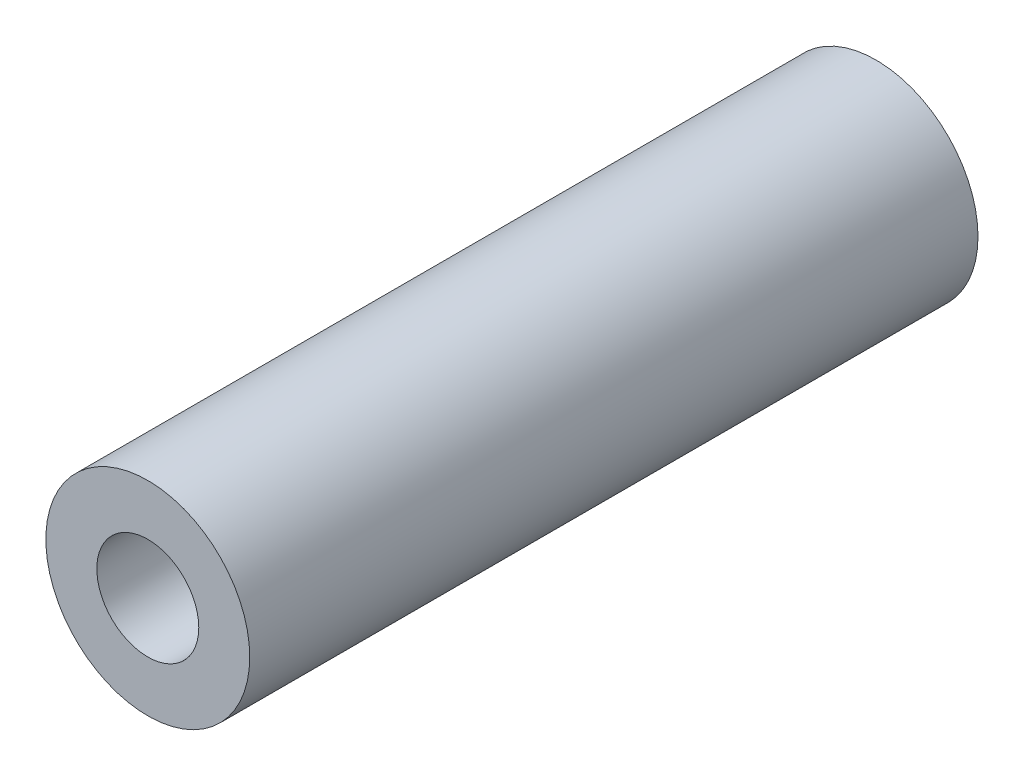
SolidWorks part; units mm, degrees
ref_plane "Plan1" through (0, 0, 0) normal (0, 0, 1) x (1, 0, 0)
ref_plane "Plan2" through (0, 0, 0) normal (0, 1, 0) x (1, 0, 0)
ref_plane "Plan3" through (0, 0, 0) normal (1, 0, 0) x (0, 0, -1)
sketch "Esquisse1" plane through (0, 0, 0) normal (0, 0, 1) x (1, 0, 0)
  circle A0 centre (0, 0) radius 3.5
  dimension "D1" = 7
extrude "Base-Extrusion" add sketch "Esquisse1" along normal blind 25
sketch "Esquisse2" plane through (0, 0, 25) normal (0, 0, 1) x (1, 0, 0)
  circle A0 centre (0, 0) radius 1.75
  dimension "D1" = 3.5
extrude "Enlèv. mat.-Extru.1" cut sketch "Esquisse2" against normal through all
